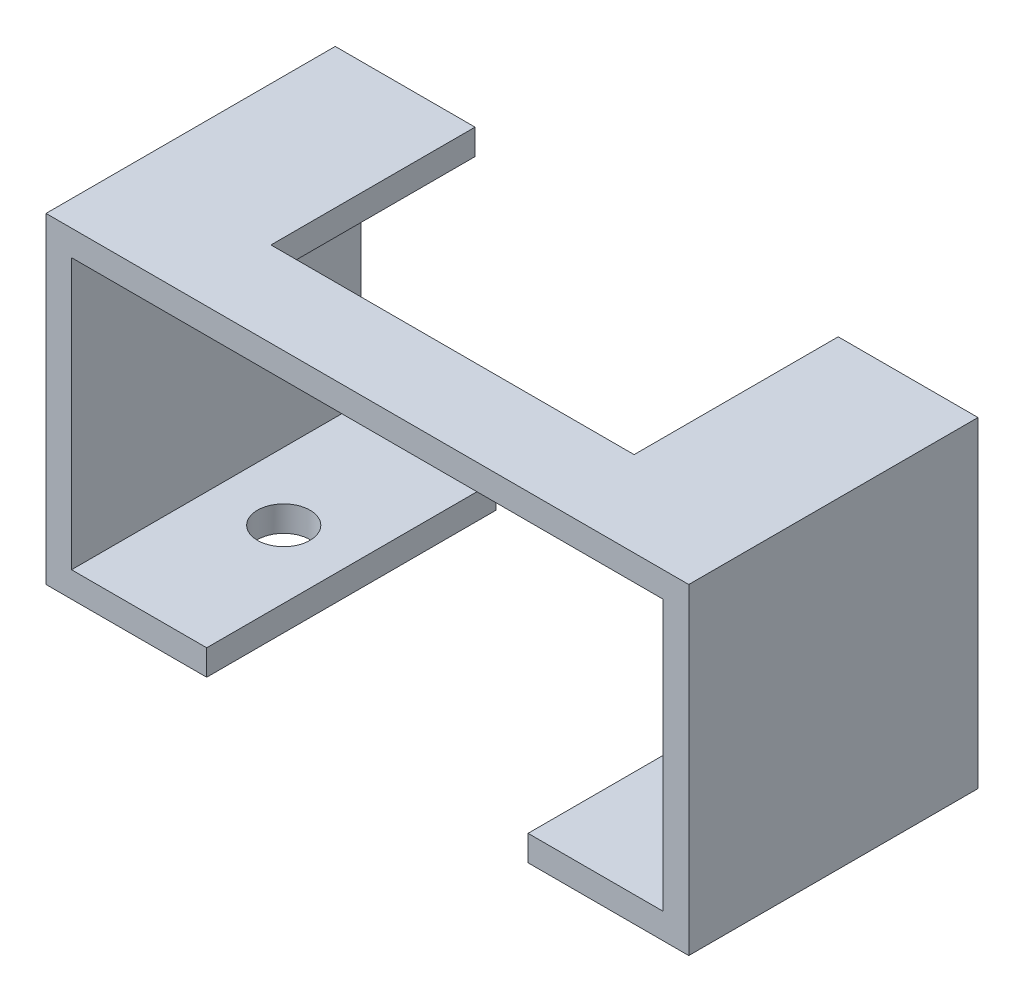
SolidWorks part; units mm, degrees
ref_plane "Front Plane" through (0, 0, 0) normal (0, 0, 1) x (1, 0, 0)
ref_plane "Top Plane" through (0, 0, 0) normal (0, 1, 0) x (1, 0, 0)
ref_plane "Right Plane" through (0, 0, 0) normal (1, 0, 0) x (0, 0, -1)
sketch "Sketch1" plane through (0, 0, 0) normal (0, 0, 1) x (1, 0, 0)
  line L0 (10, -20) -> (0, -20)
  line L1 (0, -20) -> (0, 0)
  line L2 (0, 0) -> (40, 0)
  line L3 (40, 0) -> (40, -20)
  line L4 (40, -20) -> (30, -20)
  line L5 (10, -18.41) -> (1.59, -18.41)
  line L6 (1.59, -18.41) -> (1.59, -1.59)
  line L7 (1.59, -1.59) -> (38.41, -1.59)
  line L8 (38.41, -1.59) -> (38.41, -18.41)
  line L9 (38.41, -18.41) -> (30, -18.41)
  line L10 (10, -20) -> (10, -18.41)
  line L11 (30, -20) -> (30, -18.41)
  dimension "D1" = 40
  dimension "D2" = 10
  dimension "D3" = 10
  dimension "D4" = 20
  dimension "D5" = 1.59
extrude "Boss-Extrude1" add sketch "Sketch1" along normal blind 18
sketch "Sketch2" plane through (0, 0, 0) normal (0, 1, 0) x (1, 0, 0)
  line L0 (8.7, 0) -> (8.7, -12.7)
  line L1 (40, 0) -> (0, 0) construction
  line L2 (8.7, -12.7) -> (31.3, -12.7)
  line L3 (31.3, -12.7) -> (31.3, 0)
  line L5 (20, 0) -> (20, -12.7) construction
  line L6 (8.7, 0) -> (31.3, 0)
  dimension "D1" = 22.6
  dimension "D2" = 12.7
extrude "Cut-Extrude1" cut sketch "Sketch2" against normal blind 10
hole_wizard "#4 Clearance Hole3" positions "Sketch10" profile "Sketch11" hole size "#4" standard "ANSI Inch"
sketch "Sketch10" plane through (0, -18.41, 0) normal (0, 1, 0) x (1, 0, 0)
  line L0 (1.59, -9) -> (10, -9) construction
  line L1 (1.59, -18) -> (1.59, 0) construction
  line L2 (10, -18) -> (10, 0) construction
  line L4 (30, -9) -> (38.41, -9) construction
  line L5 (30, -18) -> (30, 0) construction
  line L6 (38.41, -18) -> (38.41, 0) construction
  point P0 (5.795, -9)
  point P2 (34.205, -9)
  point P13 (5.795, -9)
  point P22 (34.205, -9)
sketch "Sketch11" plane through (5.795, -18.41, 9) normal (1, 0, 0) x (0, 0, 1)
  line L0 (0, 0) -> (0, 1.59)
  line L1 (0, 1.59) -> (1.6319, 1.59)
  line L2 (1.6319, 1.59) -> (1.6319, 0)
  line L5 (1.6319, 0) -> (0, 0)
  line L11 (0, -6.35) -> (0, 107.95) construction
  dimension "Thru Hole Dia." = 3.2639
  dimension "Thru Hole Depth" = 1.59
